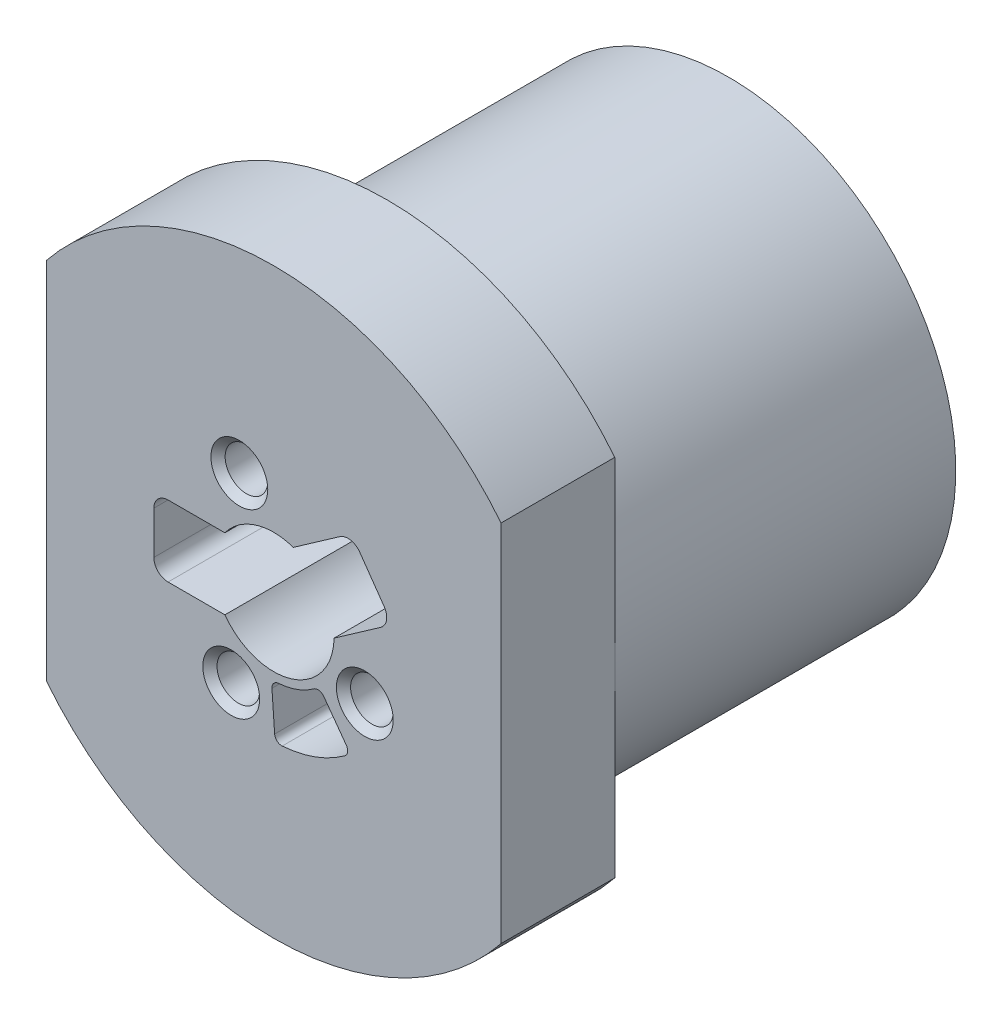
SolidWorks part; units mm, degrees
ref_plane "Plan de face" through (0, 0, 0) normal (0, 0, 1) x (1, 0, 0)
ref_plane "Plan de dessus" through (0, 0, 0) normal (0, 1, 0) x (1, 0, 0)
ref_plane "Plan de droite" through (0, 0, 0) normal (1, 0, 0) x (0, 0, -1)
sketch "Esquisse1" plane through (0, 0, 0) normal (0, 0, 1) x (1, 0, 0)
  circle A0 centre (0, 0) radius 16
  dimension "D1" = 32
extrude "Extrusion1" add sketch "Esquisse1" along normal blind 24
sketch "Esquisse2" plane through (0, 0, 24) normal (0, 0, 1) x (1, 0, 0)
  circle A0 centre (0, 0) radius 20.5
  circle A1 centre (0, 0) radius 16 construction
  dimension "D1" = 41
extrude "Extrusion2" add sketch "Esquisse2" along normal blind 8
sketch "Esquisse4" plane through (0, 0, 32) normal (0, 0, 1) x (1, 0, 0)
  line L0 (-16, 12.816) -> (-16, -12.816)
  line L1 (16, 12.816) -> (16, -12.816)
  circle A0 centre (0, 0) radius 16 construction
  arc A1 (16, -12.816) -> (16, 12.816) centre (0, 0) ccw
  arc A2 (-16, 12.816) -> (-16, -12.816) centre (0, 0) ccw
  dimension "D2" = 41
  dimension "D1" = 32
extrude "Enlèv. mat.-Extru.1" cut sketch "Esquisse4" against normal blind 8
sketch "Esquisse5" plane through (0, 0, 0) normal (0, 0, -1) x (-1, 0, 0)
  circle A0 centre (0, 0) radius 4
  circle A1 centre (0, 0) radius 16 construction
  dimension "D1" = 8
extrude "Enlèv. mat.-Extru.2" cut sketch "Esquisse5" against normal up to next
sketch "Esquisse6" plane through (0, 0, 0) normal (0, 0, -1) x (-1, 0, 0)
  line L2 (-4.7051, -6.4701) -> (-3.1171, -4.2864)
  line L3 (-0.372, -5.2869) -> (-0.5615, -7.9803)
  arc A2 (-3.1171, -4.2864) -> (-0.372, -5.2869) centre (0, 0) ccw
  arc A3 (-4.7051, -6.4701) -> (-0.5615, -7.9803) centre (0, 0) ccw
extrude "Enlèv. mat.-Extru.3" cut sketch "Esquisse6" against normal up to next
sketch "Esquisse7" plane through (0, 0, 32) normal (0, 0, 1) x (1, 0, 0)
  line L0 (4.8056, -5.7582) -> (3.8029, -4.3793) construction
  line L1 (-0.0932, -5.7993) -> (0.0265, -7.5) construction
  line L6 (-7.4369, -2.5) -> (-3.4369, -2.5)
  line L7 (-3.4369, 2.5) -> (-7.4369, 2.5)
  line L8 (4.658, 6.3135) -> (1.3814, 4.0192)
  line L9 (4.2493, -0.0765) -> (7.5259, 2.2178)
  line L10 (-0.1268, -5.322) -> (0.0627, -8.0154)
  line L11 (5.1094, -6.176) -> (3.5215, -3.9924)
  line L12 (6.0508, 6.068) -> (7.7715, 3.6105)
  line L13 (-8.4369, -1.5) -> (-8.4369, 1.5)
  arc A1 (1.3814, 4.0192) -> (-3.4369, 2.5) centre (0, 0) ccw construction
  arc A3 (-3.4369, -2.5) -> (4.2493, -0.0765) centre (0, 0) ccw construction
  arc A10 (6.0508, 6.068) -> (4.658, 6.3135) centre (5.2316, 5.4944) ccw
  arc A11 (1.3814, 4.0192) -> (-3.4369, 2.5) centre (0, 0) ccw
  arc A12 (7.7715, 3.6105) -> (7.5259, 2.2178) centre (6.9523, 3.0369) cw
  arc A13 (-3.4369, -2.5) -> (4.2493, -0.0765) centre (0, 0) ccw
  arc A14 (3.5215, -3.9924) -> (2.823, -3.8821) centre (3.1171, -4.2864) ccw
  arc A15 (0.3369, -4.7882) -> (2.823, -3.8821) centre (0, 0) ccw
  arc A16 (0.3369, -4.7882) -> (-0.1268, -5.322) centre (0.372, -5.2869) ccw
  arc A17 (0.0627, -8.0154) -> (0.5966, -8.479) centre (0.5615, -7.9803) ccw
  arc A18 (0.5966, -8.479) -> (4.9991, -6.8745) centre (0, 0) ccw
  arc A19 (4.9991, -6.8745) -> (5.1094, -6.176) centre (4.7051, -6.4701) ccw
  arc A20 (-8.4369, 1.5) -> (-7.4369, 2.5) centre (-7.4369, 1.5) cw
  arc A21 (-8.4369, -1.5) -> (-7.4369, -2.5) centre (-7.4369, -1.5) ccw
  point P21 (5.4772, 6.8871)
  point P28 (-8.4369, 2.5)
  dimension "D2" = 1
  dimension "D4" = 1
  dimension "D5" = 8.5
  dimension "D6" = 4.8
  dimension "D7" = 0.5
  dimension "D8" = 0.5
  dimension "D9" = 0.5
  dimension "D10" = 0.5
  dimension "D1" = 5
  dimension "D3" = 5
extrude "Enlèv. mat.-Extru.4" cut sketch "Esquisse7" against normal blind 20
sketch "Esquisse8" plane through (0, 0, 0) normal (0, 0, -1) x (-1, 0, 0)
  line L0 (-22.5864, 0) -> (23.0458, 0) construction
  line L1 (0, 22.0887) -> (0, -21.7824) construction
  circle A0 centre (2.99, -6.41) radius 1.5
  circle A1 centre (2.42, 6.64) radius 1.5
  circle A2 centre (-6.41, -2.99) radius 1.5
  dimension "D1" = 3
  dimension "D2" = 3
  dimension "D3" = 3
  dimension "D4" = 6.64
  dimension "D5" = 2.42
  dimension "D6" = 2.99
  dimension "D7" = 6.41
  dimension "D8" = 6.41
  dimension "D9" = 2.99
extrude "Enlèv. mat.-Extru.5" cut sketch "Esquisse8" against normal up to next
chamfer "Chanfrein1" distance 0.5 angle 45 3 edges at (-0.92, 6.64, 32) (7.91, -2.99, 32) (-1.49, -6.41, 32)
sketch "Esquisse9" plane through (0, 0, 0) normal (0, 0, -1) x (-1, 0, 0)
  line L0 (0, 0) -> (29.5897, -11.9698) construction
  line L1 (-3.1171, -4.2864) -> (-4.7051, -6.4701) construction
  line L2 (0, 0) -> (32.1406, -3.9604) construction
  line L3 (5.911, -2.7584) -> (9.5747, -1.64)
  line L4 (9.7634, -0.7904) -> (7.1025, 1.6075)
  line L5 (5.911, -2.7584) -> (9.0886, -13.168)
  line L6 (7.1025, 1.6075) -> (13.4556, 8.6572)
  line L7 (0, 0) -> (-21.991, 18.4687) construction
  line L8 (0, 0) -> (19.5884, 21.7363) construction
  line L9 (7.1904, -6.9497) -> (0, 0) construction
  circle A0 centre (0, 0) radius 10 construction
  arc A1 (9.5747, -1.64) -> (9.7634, -0.7904) centre (9.4287, -1.1618) ccw
  circle A2 centre (0, 0) radius 16 construction
  arc A3 (9.0886, -13.168) -> (13.4556, 8.6572) centre (0, 0) ccw
  dimension "D3" = 20
  dimension "D4" = 1
  dimension "D1" = 104
  dimension "D2" = 15
  dimension "D5" = 35
  dimension "D6" = 18
  dimension "D7" = 90
  dimension "D8" = 29
  dimension "D9" = 22
  dimension "D10" = 4.2
extrude "Extrusion3" add sketch "Esquisse9" along normal blind 4.36
